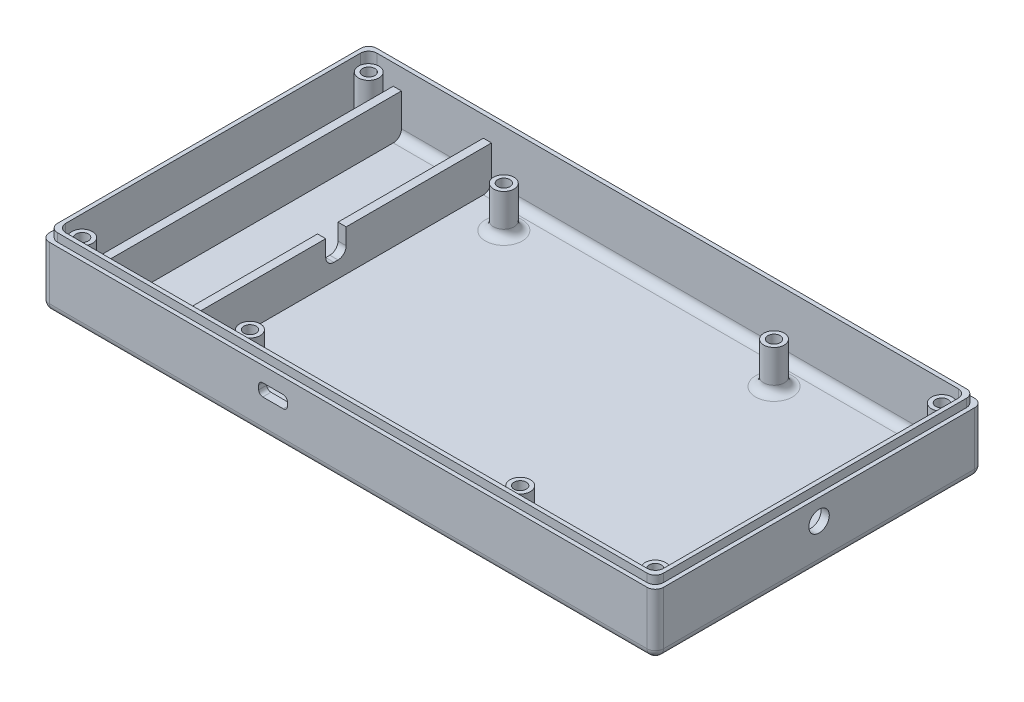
SolidWorks part; units mm, degrees
ref_plane "Front Plane" through (0, 0, 0) normal (0, 0, 1) x (1, 0, 0)
ref_plane "Top Plane" through (0, 0, 0) normal (0, 1, 0) x (1, 0, 0)
ref_plane "Right Plane" through (0, 0, 0) normal (1, 0, 0) x (0, 0, -1)
sketch "Sketch1" plane through (0, 0, 0) normal (0, 1, 0) x (1, 0, 0)
  line L1 (-75, 40) -> (75, 40)
  line L2 (-75, 40) -> (-75, -40)
  line L3 (-75, -40) -> (75, -40)
  line L4 (75, 40) -> (75, -40)
  line L5 (-75, 40) -> (75, -40) construction
  line L6 (-75, -40) -> (75, 40) construction
  point P0 (0, 0)
  dimension "D1" = 150
  dimension "D2" = 80
extrude "Boss-Extrude1" add sketch "Sketch1" along normal blind 15
sketch "Sketch2" plane through (0, 15, 0) normal (0, 1, 0) x (1, 0, 0)
  line L0 (-75, 40) -> (-75, -40) construction
  line L1 (-74, 39) -> (74, 39)
  line L2 (-74, 39) -> (-74, -39)
  line L3 (-74, -39) -> (74, -39)
  line L4 (74, 39) -> (74, -39)
  line L5 (-74, 39) -> (74, -39) construction
  line L6 (-74, -39) -> (74, 39) construction
  line L7 (75, 40) -> (-75, 40) construction
  point P0 (0, 0)
  dimension "D1" = 1
  dimension "D2" = 1
extrude "Boss-Extrude2" add sketch "Sketch2" along normal blind 2
sketch "Sketch3" plane through (0, 17, 0) normal (0, 1, 0) x (1, 0, 0)
  line L0 (-75, 40) -> (-75, -40) construction
  line L1 (-73, 38) -> (73, 38)
  line L2 (-73, 38) -> (-73, -38)
  line L3 (-73, -38) -> (73, -38)
  line L4 (73, 38) -> (73, -38)
  line L5 (-73, 38) -> (73, -38) construction
  line L6 (-73, -38) -> (73, 38) construction
  line L7 (75, 40) -> (-75, 40) construction
  point P0 (0, 0)
  dimension "D1" = 2
  dimension "D2" = 2
extrude "Cut-Extrude1" cut sketch "Sketch3" against normal blind 15
sketch "Sketch4" plane through (75, 0, 0) normal (1, 0, 0) x (0, 0, -1)
  circle A0 centre (0, 10) radius 2.5
  dimension "D1" = 5
  dimension "D2" = 10
extrude "Cut-Extrude2" cut sketch "Sketch4" against normal up to next
sketch "Sketch5" plane through (0, 15, 0) normal (0, 1, 0) x (1, 0, 0)
  line L0 (73, 38) -> (-73, 38) construction
  line L1 (-73, 38) -> (-73, -38) construction
  line L2 (0, 0) -> (0, 63.1963) construction
  line L3 (0, 0) -> (-32.6736, 0) construction
  circle A0 centre (-70, 35) radius 2.5
  circle A1 centre (-70, -35) radius 2.5
  circle A2 centre (70, -35) radius 2.5
  circle A3 centre (70, 35) radius 2.5
  dimension "D3" = 5
  dimension "D1" = 3
  dimension "D2" = 3
extrude "Boss-Extrude3" add sketch "Sketch5" against normal up to surface (13 mm away)
sketch "Sketch6" plane through (0, 15, 0) normal (0, 1, 0) x (1, 0, 0)
  line L0 (0, 0) -> (0, 31.1013) construction
  line L1 (0, 0) -> (-21.4242, 0) construction
  circle A0 centre (-70, 35) radius 1.5
  circle A1 centre (-70, -35) radius 1.5
  circle A2 centre (70, -35) radius 1.5
  circle A3 centre (70, 35) radius 1.5
  dimension "D1" = 3
extrude "Cut-Extrude3" cut sketch "Sketch6" against normal blind 15
fillet "Fillet1" radius 2 20 edges at (0, 2, 38) (-73, 2, 0) (0, 2, -38) (73, 2, 0) (0, 0, -40) (-75, 0, 0) (0, 0, 40) (75, 0, 0) (-70, 0, -33.5) (-70, 0, 33.5) (70, 0, 36.5) (70, 0, -36.5) (-74, 16, -39) (-75, 7.5, -40) (-74, 16, 39) (-75, 7.5, 40) (74, 16, 39) (75, 7.5, 40) (74, 16, -39) (75, 7.5, -40)
fillet "Fillet2" radius 2 8 edges at (72.6637, 2.8899, 37.6637) (-72.6637, 2.8899, 37.6637) (-72.6637, 2.8899, -37.6637) (72.6637, 2.8899, -37.6637) (73, 10.5, 38) (-73, 10.5, 38) (-73, 10.5, -38) (73, 10.5, -38)
sketch "Sketch7" plane through (0, 2, 0) normal (0, 1, 0) x (1, 0, 0)
  line L0 (-71, 38) -> (71, 38) construction
  line L1 (-67, 38) -> (-65, 38)
  line L2 (-67, 38) -> (-67, -36)
  line L3 (-67, -36) -> (-65, -36)
  line L4 (-65, 38) -> (-65, -36)
  line L5 (-67.7087, -36) -> (67.7087, -36) construction
  line L6 (-71, 32.7087) -> (-71, -32.7087) construction
  line L7 (-43, 38) -> (-45, 38)
  line L8 (-43, 38) -> (-43, -36)
  line L9 (-43, -36) -> (-45, -36)
  line L10 (-45, 38) -> (-45, -36)
  dimension "D1" = 4
  dimension "D2" = 20
  dimension "D3" = 2
extrude "Boss-Extrude4" add sketch "Sketch7" along normal blind 10
sketch "Sketch8" plane through (0, 12, 0) normal (0, 1, 0) x (1, 0, 0)
  line L0 (-45, 38) -> (-45, -36) construction
  line L1 (-45, 2.5) -> (-43, 2.5)
  line L2 (-45, 2.5) -> (-45, -2.5)
  line L3 (-45, -2.5) -> (-43, -2.5)
  line L4 (-43, 2.5) -> (-43, -2.5)
  line L5 (-43, -36) -> (-43, 38) construction
  point P8 (-45, 0)
  dimension "D1" = 5
extrude "Cut-Extrude4" cut sketch "Sketch8" against normal blind 6
sketch "Sketch9" plane through (0, 12, 0) normal (0, 1, 0) x (1, 0, 0)
  line L0 (71, 38) -> (-71, 38) construction
  line L1 (-43, -36) -> (-43, 36) construction
  line L2 (0, 0) -> (0, -24.1508) construction
  line L3 (0, 0) -> (21.2017, 0) construction
  circle A0 centre (-33, 31) radius 2.5
  circle A1 centre (33, 31) radius 2.5
  circle A2 centre (33, -31) radius 2.5
  circle A3 centre (-33, -31) radius 2.5
  dimension "D1" = 5
  dimension "D2" = 7
  dimension "D3" = 10
extrude "Boss-Extrude5" add sketch "Sketch9" against normal up to surface (10 mm away)
sketch "Sketch10" plane through (0, 12, 0) normal (0, 1, 0) x (1, 0, 0)
  line L0 (0, 0) -> (0, 22.5091) construction
  line L1 (0, 0) -> (15.2364, 0) construction
  circle A0 centre (-33, 31) radius 1.5
  circle A1 centre (33, 31) radius 1.5
  circle A2 centre (33, -31) radius 1.5
  circle A3 centre (-33, -31) radius 1.5
  dimension "D1" = 3
extrude "Cut-Extrude5" cut sketch "Sketch10" against normal blind 5
sketch "Sketch11" plane through (0, 0, 40) normal (0, 0, 1) x (1, 0, 0)
  line L1 (-21.875, 11.3265) -> (-14.875, 11.3265)
  line L2 (-21.875, 11.3265) -> (-21.875, 8.3265)
  line L3 (-21.875, 8.3265) -> (-14.875, 8.3265)
  line L4 (-14.875, 11.3265) -> (-14.875, 8.3265)
  dimension "D1" = 7
  dimension "D2" = 3
extrude "Cut-Extrude6" cut sketch "Sketch11" against normal up to next
fillet "Fillet3" radius 2 4 edges at (-33, 2, 33.5) (33, 2, 33.5) (33, 2, -28.5) (-33, 2, -28.5)
fillet "Fillet4" radius 1 4 edges at (-21.875, 11.3265, 39) (-14.875, 11.3265, 39) (-14.875, 8.3265, 39) (-21.875, 8.3265, 39)
fillet "Fillet5" radius 2 2 edges at (-44, 6, 2.5) (-44, 6, -2.5)
